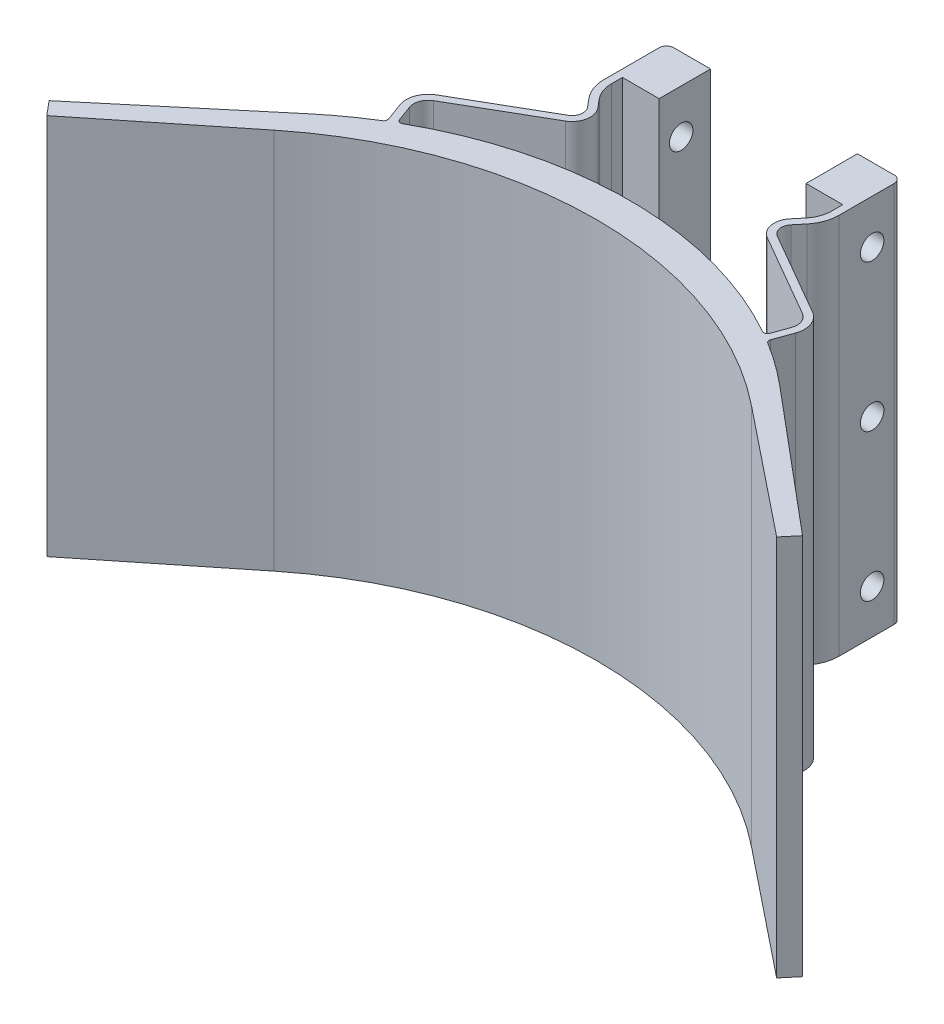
SolidWorks part; units mm, degrees
ref_plane "前视基准面" through (0, 0, 0) normal (0, 0, 1) x (1, 0, 0)
ref_plane "上视基准面" through (0, 0, 0) normal (0, 1, 0) x (1, 0, 0)
ref_plane "右视基准面" through (0, 0, 0) normal (1, 0, 0) x (0, 0, -1)
other "Configuration Table"
sketch "草图1" plane through (0, 0, 0) normal (0, 1, 0) x (1, 0, 0)
  line L0 (-10, -3) -> (-15, -3)
  line L1 (-10, 4) -> (-16, 4)
  line L2 (-10, 4) -> (-10, -3)
  line L15 (-16, 4) -> (-16, -4.5)
  line L24 (-15, -3) -> (-15, -4.5)
  line L29 (0, 0) -> (0, -7.8) construction
  line L47 (-32.1394, -28.6978) -> (-51.2905, -44.7675)
  line L48 (-51.2905, -44.7675) -> (-49.6835, -46.6826)
  line L49 (-49.6835, -46.6826) -> (-32.5, -32.9248)
  line L50 (32.1394, -28.6978) -> (51.2905, -44.7675)
  line L51 (51.2905, -44.7675) -> (49.6835, -46.6826)
  line L52 (49.6835, -46.6826) -> (32.5, -32.9248)
  line L63 (-25.8758, -24.2163) -> (-25, -23.6987) construction
  line L64 (-25.1029, -18.5839) -> (-13.75, -12.0293)
  line L90 (-25.6029, -17.7179) -> (-14.25, -11.1633)
  line L91 (-14.0694, -7.0738) -> (-13.0781, -8.2654)
  line L92 (-14.8382, -7.7133) -> (-13.8468, -8.905)
  line L93 (-26.9219, -21.342) -> (-25.8758, -24.2163)
  line L94 (-25, -23.6987) -> (-25.9823, -21)
  line L95 (25.8758, -24.2163) -> (25, -23.6987) construction
  line L96 (25, -23.6987) -> (25.9823, -21)
  line L97 (26.9219, -21.342) -> (25.8758, -24.2163)
  line L98 (14.8382, -7.7133) -> (13.8468, -8.905)
  line L99 (14.0694, -7.0738) -> (13.0781, -8.2654)
  line L100 (25.6029, -17.7179) -> (14.25, -11.1633)
  line L101 (25.1029, -18.5839) -> (13.75, -12.0293)
  line L102 (15, -3) -> (15, -4.5)
  line L103 (16, 4) -> (16, -4.5)
  line L104 (10, 4) -> (10, -3)
  line L105 (10, 4) -> (16, 4)
  line L106 (10, -3) -> (15, -3)
  arc A0 (-25, -23.6987) -> (25, -23.6987) centre (0, -67) cw
  arc A1 (-25.8758, -24.2163) -> (-32.1394, -28.6978) centre (0, -67) ccw
  arc A2 (25.8758, -24.2163) -> (32.1394, -28.6978) centre (0, -67) cw
  arc A3 (-32.5, -32.9248) -> (32.5, -32.9248) centre (0, -73.5172) cw
  arc A4 (-15, -4.5) -> (-14.0694, -7.0738) centre (-10.9755, -4.5) ccw
  arc A5 (-16, -4.5) -> (-14.8382, -7.7133) centre (-10.9755, -4.5) ccw
  arc A6 (-25.9823, -21) -> (-25.1029, -18.5839) centre (-24.1029, -20.316) cw
  arc A7 (-26.9219, -21.342) -> (-25.6029, -17.7179) centre (-24.1029, -20.316) cw
  arc A8 (-13.0781, -8.2654) -> (-13.75, -12.0293) centre (-15, -9.8643) cw
  arc A9 (-13.8468, -8.905) -> (-14.25, -11.1633) centre (-15, -9.8643) cw
  arc A10 (13.8468, -8.905) -> (14.25, -11.1633) centre (15, -9.8643) ccw
  arc A11 (13.0781, -8.2654) -> (13.75, -12.0293) centre (15, -9.8643) ccw
  arc A12 (26.9219, -21.342) -> (25.6029, -17.7179) centre (24.1029, -20.316) ccw
  arc A13 (25.9823, -21) -> (25.1029, -18.5839) centre (24.1029, -20.316) ccw
  arc A14 (16, -4.5) -> (14.8382, -7.7133) centre (10.9755, -4.5) cw
  arc A15 (15, -4.5) -> (14.0694, -7.0738) centre (10.9755, -4.5) cw
  point P8 (-18.2893, -19.9718)
  point P13 (0, 0)
  point P25 (0, -17)
  point P27 (-20.2117, -14.8676)
  point P60 (-23.5316, -22.8835)
  point P61 (-24.7852, -17.749)
  point P62 (0, 0)
  point P63 (-12.9292, -8.169)
  point P64 (-13, -10.1831)
  point P65 (-14, -9.9313)
  point P66 (-25.8492, -24.2002)
  point P67 (-15.1304, -9.6349)
  point P68 (-15.4419, -9.8955)
  point P69 (-24.2461, -18.6584)
  point P70 (-13.925, -12.7022)
  dimension "D12" = 1
  dimension "D8" = 17
  dimension "D11" = 50
  dimension "D13" = 50
  dimension "D16" = 2.5
  dimension "D17" = 178.639
  dimension "D18" = 25
  dimension "D22" = 360
  dimension "D7" = 2.5
  dimension "D6" = 1
  dimension "D9" = 25
  dimension "D10" = 3
  dimension "D20" = 1.5
  dimension "D24" = 52
  dimension "D2" = 10
  dimension "D3" = 6
  dimension "D4" = 3
  dimension "D5" = 4
  dimension "D14" = 50
  dimension "D15" = 50
  dimension "D19" = 65
  dimension "D21" = 21
  dimension "D23" = 2
  dimension "D25" = 20
  dimension "D26" = 60
extrude "凸台-拉伸1" add sketch "草图1" along normal blind 52
sketch "草图2" plane through (16, 0, 0) normal (1, 0, 0) x (0, 0, -1)
  line L0 (0, 6) -> (0, 26) construction
  line L5 (4, 52) -> (4, 0) construction
  line L6 (-4.5, 0) -> (4, 0) construction
  circle A0 centre (0, 6) radius 1.6
  circle A1 centre (0, 26) radius 1.6
  circle A2 centre (0, 46) radius 1.6
  dimension "D3" = 3.2
  dimension "D2" = 20
  dimension "D4" = 4
  dimension "D5" = 6
  dimension "D1" = 3
extrude "切除-拉伸1" cut sketch "草图2" against normal through all
fillet "圆角2" radius 1 2 edges at (-16, 26, -4) (16, 26, -4)
fillet "圆角4" radius 0.5 4 edges at (-25.8758, 26, 24.2163) (-25, 26, 23.6987) (25, 26, 23.6987) (25.8758, 26, 24.2163)
